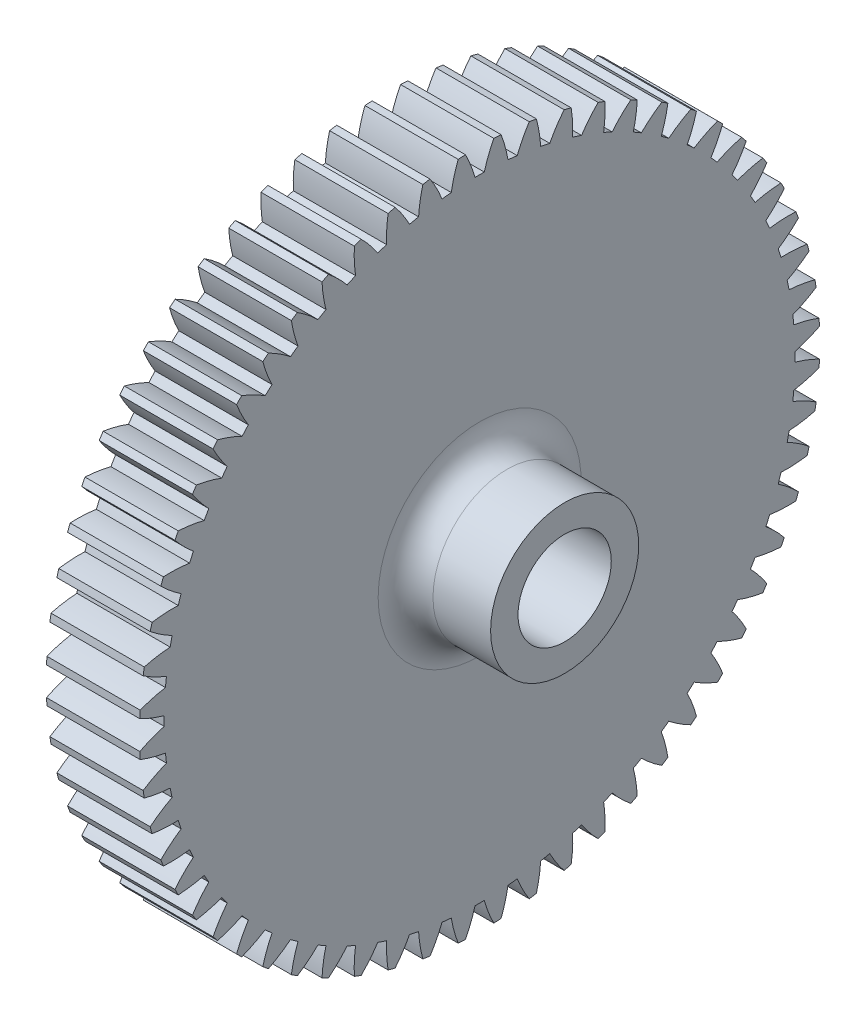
SolidWorks part; units mm, degrees
ref_plane "Plane1" through (0, 0, 0) normal (0, 0, 1) x (1, 0, 0)
ref_plane "Plane2" through (0, 0, 0) normal (0, 1, 0) x (1, 0, 0)
ref_plane "Plane3" through (0, 0, 0) normal (1, 0, 0) x (0, 0, -1)
other "Configuration Table"
sketch "HoldingSke" plane through (0, 0, 0) normal (0, 1, 0) x (1, 0, 0)
  line L0 (0, 0) -> (0.25, -0.433)
  line L1 (-15, 0) -> (100, 0) construction
  line L2 (0, 0) -> (-2.1039, 2.3779)
  line L3 (0, 0) -> (-11.863, 4.5341)
  line L4 (0, 0) -> (4.318, 7.479)
  line L5 (0, 0) -> (-46.8476, -17.4728)
  line L6 (0, 0) -> (-14.0924, -9.5082)
  line L7 (-2.1039, 2.3779) -> (8.6586, 51.2059)
  line L8 (-76.2, 54.61) -> (-76.1, 54.61)
  line L9 (-71.009, 38.7566) -> (-53.1078, 45.2721)
  line L10 (-76.2, 71.12) -> (104.1128, 71.12)
  line L11 (0, 0) -> (-17, 0)
  line L12 (-76.2, 101.6) -> (-76.133, 101.6)
  line L13 (24.9733, 27.94) -> (52.9518, 28.4284)
  line L14 (24.9733, 27.94) -> (24.9743, 27.94)
  line L15 (24.9733, 27.94) -> (100.4006, 29.5858)
  line L16 (-63.627, -2) -> (-12.827, -2)
  circle A0 centre (0, 0) radius 0.4
  circle A1 centre (0, 0) radius 37.5
  circle A2 centre (0, 0) radius 37.5
  circle A3 centre (0, 0) radius 0.4
sketch "BasProSke" plane through (0, 0, 0) normal (0, 1, 0) x (1, 0, 0)
  line L0 (-10, 0) -> (60, 0) construction
  line L1 (0, 0) -> (0, 62)
  line L2 (0, 0) -> (17, 0)
  line L3 (17, 0) -> (17, 62)
  line L4 (17, 62) -> (0, 62)
revolve "Base-Revolve" add sketch "BasProSke" angle 360 about L0
sketch "TooCutSke" plane through (0, 0, 0) normal (1, 0, 0) x (0, 0, -1)
  line L1 (0, 0) -> (0, 107) construction
  line L2 (0, 0) -> (-1.6879, 59.9763) construction
  line L3 (0, 0) -> (-6.2785, 119.8004) construction
  line L4 (-1.6879, 59.9763) -> (-3.1392, 59.9002) construction
  arc A0 (0.8455, 57.4928) -> (-0.8455, 57.4928) centre (0, 0) ccw
  arc A1 (2.5963, 61.971) -> (-2.5963, 61.971) centre (0, 0) ccw
  circle A2 centre (0, 0) radius 60 construction
  circle A3 centre (0, 0) radius 56.3816 construction
  arc A4 (-0.8455, 57.4928) -> (-2.5963, 61.971) centre (-23.9609, 51.0368) ccw
  arc A5 (2.5963, 61.971) -> (0.8455, 57.4928) centre (23.9609, 51.0368) ccw
extrude "ToothCut" cut sketch "TooCutSke" along normal through all
fillet "Breaks" [suppressed] radius 0.04
fillet "RootFillets" [suppressed] radius 0.501
pattern_circular "TeethCuts" count 60 every 6 about axis through (-10, 0, 0) along (1, 0, 0) of "ToothCut", "RootFillets", "Breaks"
sketch "HubNeaOneSke" plane through (0, 0, 0) normal (-1, 0, 0) x (0, 0, 1)
  circle A0 centre (0, 0) radius 37.5
extrude "HubNearOne" [suppressed] add sketch "HubNeaOneSke" along normal blind 33.0001
sketch "HubNeaBotSke" plane through (0, 0, 0) normal (-1, 0, 0) x (0, 0, 1)
  circle A0 centre (0, 0) radius 37.5
extrude "HubNearBoth" [suppressed] add sketch "HubNeaBotSke" along normal blind 16.5
ref_plane "FarPln" through (17, 0, 0) normal (1, 0, 0) x (0, 0, -1)
sketch "HubFarSke" plane through (17, 0, 0) normal (1, 0, 0) x (0, 0, -1)
  circle A0 centre (0, 0) radius 37.5
extrude "HubFar" [suppressed] add sketch "HubFarSke" along normal blind 16.5
sketch "BorSke" plane through (0, 0, 0) normal (1, 0, 0) x (0, 0, -1)
  circle A0 centre (0, 0) radius 0.4
extrude "Bore" cut sketch "BorSke" along normal mid plane 100.0001
sketch "KeySke" plane through (0, 0, 0) normal (1, 0, 0) x (0, 0, -1)
  line L0 (-0.05, 0) -> (-0.05, 0.5)
  line L1 (-0.05, 0.5) -> (0.05, 0.5)
  line L2 (0.05, 0.5) -> (0.05, 0)
  line L3 (0, 0) -> (0, 34) construction
  line L4 (-0.05, 0) -> (0.05, 0)
extrude "Keyway" [suppressed] cut sketch "KeySke" along normal mid plane 100.0001
pattern_circular "Keyway2" [suppressed] count 2 every 90 about axis through (-10, 0, 0) along (1, 0, 0)
sketch "Croquis1" plane through (17, 0, 0) normal (1, 0, 0) x (0, 0, -1)
  line L0 (0, 0) -> (0, 7.5) construction
  line L1 (-0.5433, 6.8284) -> (-0.6, 7.476)
  line L2 (0.5433, 6.8284) -> (0.6, 7.476)
  line L3 (1.8249, 6.6024) -> (1.9931, 7.2303)
  line L4 (2.846, 6.2308) -> (3.1207, 6.8199)
  line L5 (3.973, 5.5801) -> (4.3458, 6.1126)
  line L6 (4.8054, 4.8816) -> (5.2651, 5.3412)
  line L7 (5.6419, 3.8848) -> (6.1744, 4.2576)
  line L8 (6.1853, 2.9437) -> (6.7744, 3.2184)
  line L9 (6.6303, 1.7208) -> (7.2582, 1.8891)
  line L10 (6.819, 0.6506) -> (7.4666, 0.7073)
  line L11 (6.819, -0.6506) -> (7.4666, -0.7073)
  line L12 (6.6303, -1.7208) -> (7.2582, -1.8891)
  line L13 (6.1853, -2.9437) -> (6.7744, -3.2184)
  line L14 (5.6419, -3.8848) -> (6.1744, -4.2576)
  line L15 (4.8054, -4.8816) -> (5.2651, -5.3412)
  line L16 (3.973, -5.5801) -> (4.3458, -6.1126)
  line L17 (2.846, -6.2308) -> (3.1207, -6.8199)
  line L18 (1.8249, -6.6024) -> (1.9931, -7.2303)
  line L19 (0.5433, -6.8284) -> (0.6, -7.476)
  line L20 (-0.5433, -6.8284) -> (-0.6, -7.476)
  line L21 (-1.8249, -6.6024) -> (-1.9931, -7.2303)
  line L22 (-2.846, -6.2308) -> (-3.1207, -6.8199)
  line L23 (-3.973, -5.5801) -> (-4.3458, -6.1126)
  line L24 (-4.8054, -4.8816) -> (-5.2651, -5.3412)
  line L25 (-5.6419, -3.8848) -> (-6.1744, -4.2576)
  line L26 (-6.1853, -2.9437) -> (-6.7744, -3.2184)
  line L27 (-6.6303, -1.7208) -> (-7.2582, -1.8891)
  line L28 (-6.819, -0.6506) -> (-7.4666, -0.7073)
  line L29 (-6.819, 0.6506) -> (-7.4666, 0.7073)
  line L30 (-6.6303, 1.7208) -> (-7.2582, 1.8891)
  line L31 (-6.1853, 2.9437) -> (-6.7744, 3.2184)
  line L32 (-5.6419, 3.8848) -> (-6.1744, 4.2576)
  line L33 (-4.8054, 4.8816) -> (-5.2651, 5.3412)
  line L34 (-3.973, 5.5801) -> (-4.3458, 6.1126)
  line L35 (-2.846, 6.2308) -> (-3.1207, 6.8199)
  line L36 (-1.8249, 6.6024) -> (-1.9931, 7.2303)
  arc A0 (-0.5433, 6.8284) -> (-1.8249, 6.6024) centre (0, 0) ccw
  arc A1 (0.6, 7.476) -> (-0.6, 7.476) centre (0, 0) ccw
  arc A2 (3.1207, 6.8199) -> (1.9931, 7.2303) centre (0, 0) ccw
  arc A3 (5.2651, 5.3412) -> (4.3458, 6.1126) centre (0, 0) ccw
  arc A4 (6.7744, 3.2184) -> (6.1744, 4.2576) centre (0, 0) ccw
  arc A5 (7.4666, 0.7073) -> (7.2582, 1.8891) centre (0, 0) ccw
  arc A6 (7.2582, -1.8891) -> (7.4666, -0.7073) centre (0, 0) ccw
  arc A7 (6.1744, -4.2576) -> (6.7744, -3.2184) centre (0, 0) ccw
  arc A8 (4.3458, -6.1126) -> (5.2651, -5.3412) centre (0, 0) ccw
  arc A9 (1.9931, -7.2303) -> (3.1207, -6.8199) centre (0, 0) ccw
  arc A10 (-0.6, -7.476) -> (0.6, -7.476) centre (0, 0) ccw
  arc A11 (-3.1207, -6.8199) -> (-1.9931, -7.2303) centre (0, 0) ccw
  arc A12 (-5.2651, -5.3412) -> (-4.3458, -6.1126) centre (0, 0) ccw
  arc A13 (-6.7744, -3.2184) -> (-6.1744, -4.2576) centre (0, 0) ccw
  arc A14 (-7.4666, -0.7073) -> (-7.2582, -1.8891) centre (0, 0) ccw
  arc A15 (-7.2582, 1.8891) -> (-7.4666, 0.7073) centre (0, 0) ccw
  arc A16 (-6.1744, 4.2576) -> (-6.7744, 3.2184) centre (0, 0) ccw
  arc A17 (-4.3458, 6.1126) -> (-5.2651, 5.3412) centre (0, 0) ccw
  arc A18 (-1.9931, 7.2303) -> (-3.1207, 6.8199) centre (0, 0) ccw
  arc A19 (-2.846, 6.2308) -> (-3.973, 5.5801) centre (0, 0) ccw
  arc A20 (-4.8054, 4.8816) -> (-5.6419, 3.8848) centre (0, 0) ccw
  arc A21 (-6.1853, 2.9437) -> (-6.6303, 1.7208) centre (0, 0) ccw
  arc A22 (-6.819, 0.6506) -> (-6.819, -0.6506) centre (0, 0) ccw
  arc A23 (-6.6303, -1.7208) -> (-6.1853, -2.9437) centre (0, 0) ccw
  arc A24 (-5.6419, -3.8848) -> (-4.8054, -4.8816) centre (0, 0) ccw
  arc A25 (-3.973, -5.5801) -> (-2.846, -6.2308) centre (0, 0) ccw
  arc A26 (-1.8249, -6.6024) -> (-0.5433, -6.8284) centre (0, 0) ccw
  arc A27 (0.5433, -6.8284) -> (1.8249, -6.6024) centre (0, 0) ccw
  arc A28 (2.846, -6.2308) -> (3.973, -5.5801) centre (0, 0) ccw
  arc A29 (4.8054, -4.8816) -> (5.6419, -3.8848) centre (0, 0) ccw
  arc A30 (6.1853, -2.9437) -> (6.6303, -1.7208) centre (0, 0) ccw
  arc A31 (5.6419, 3.8848) -> (4.8054, 4.8816) centre (0, 0) ccw
  arc A32 (3.973, 5.5801) -> (2.846, 6.2308) centre (0, 0) ccw
  arc A33 (1.8249, 6.6024) -> (0.5433, 6.8284) centre (0, 0) ccw
  arc A34 (6.819, -0.6506) -> (6.819, 0.6506) centre (0, 0) ccw
  arc A35 (6.6303, 1.7208) -> (6.1853, 2.9437) centre (0, 0) ccw
  point P78 (0, 0)
  dimension "D1" = 13.7
  dimension "D2" = 15
  dimension "D3" = 10
  dimension "D4" = 1.2
  dimension "D5" = 18
extrude "Cortar-Extruir1" cut sketch "Croquis1" against normal through all
sketch "Croquis2" plane through (17, 0, 0) normal (1, 0, 0) x (0, 0, -1)
  circle A0 centre (0, 0) radius 8.5
  circle A1 centre (0, 0) radius 13.5
  dimension "D1" = 5
  dimension "D2" = 17
extrude "Saliente-Extruir1" add sketch "Croquis2" along normal blind 15.5
fillet "Redondeo1" radius 5 1 edges at (17, 0, 13.5)
equation "' \"Module@HoldingSke\" = 6.35"
equation "' \"Num_teeth@HoldingSke\" = 12"
equation "' \"Ap@HoldingSke\" =  20"
equation "' \"Ap@HoldingSke\" = 20"
equation "' \"Width@HoldingSke\" = 0.5 * 25.4"
equation "' \"Hub_dia@HoldingSke\"= 1 * 25.4"
equation "' \"Hub_dia@HoldingSke\" = 1 * 25.4"
equation "' \"Overall_len@HoldingSke\" = 1.0 * 25.4"
equation "' \"Bore@HoldingSke\" = 0.75 * 25.4"
equation "' \"T_dim@HoldingSke\" = 0.1 * 25.4"
equation "' \"Width@KeySke\" = 0.25 * 25.4"
equation "' \"Show_teeth@HoldingSke\" = 13"
equation "' \"Backlash@HoldingSke\" = 0.009 * 25.4"
equation "' \"Addendum_fac@HoldingSke\" = 1.0"
equation "' \"Dedendum_fac@HoldingSke\" = 1.25"
equation "' \"Dedendum_add@HoldingSke\" = 0.00005 * 25.4"
equation "' \"Clearance_fac@HoldingSke\" = 0.25"
equation "\"Pitch@HoldingSke\" = 1 / \"Module@HoldingSke\""
equation "\"Overcut_dia@TooCutSke\" = (\"Num_teeth@HoldingSke\" + 2 * \"Addendum_fac@HoldingSke\") / \"Pitch@HoldingSke\" + 0.002 * 25.4"
equation "\"Pitch_dia@TooCutSke\" = \"Num_teeth@HoldingSke\" / \"Pitch@HoldingSke\""
equation "\"Base_dia@TooCutSke\" = \"Num_teeth@HoldingSke\" / \"Pitch@HoldingSke\" * cos((\"Ap@HoldingSke\"  * 3.14159265 / 180))"
equation "\"Root_dia@TooCutSke\" = (\"Num_teeth@HoldingSke\" + 2) / \"Pitch@HoldingSke\" - 2 * (\"Addendum_fac@HoldingSke\" + \"Dedendum_fac@HoldingSke\") / \"Pitch@HoldingSke\" - \"Dedendum_add@HoldingSke\" * 2"
equation "\"Half_ang@TooCutSke\" = 180 / \"Num_teeth@HoldingSke\""
equation "\"Half_CT@TooCutSke\" = \"Num_teeth@HoldingSke\" / \"Pitch@HoldingSke\" * sin((3.14159265 / 2 / \"Num_teeth@HoldingSke\")) / 2 - 7 * \"Backlash@HoldingSke\" / 4"
equation "\"Flank_rad@TooCutSke\" = \"Num_teeth@HoldingSke\" / \"Pitch@HoldingSke\" / 5"
equation "\"Radius@RootFillets\" = \"Clearance_fac@HoldingSke\" / \"Pitch@HoldingSke\" + \"Dedendum_add@HoldingSke\""
equation "\"Break_rad@Breaks\" = 0.02 / \"Pitch@HoldingSke\""
equation "\"Thickness@HoldingSke\" = \"Width@HoldingSke\""
equation "\"OAL@HoldingSke\" = \"Thickness@HoldingSke\""
equation "\"MHD@HoldingSke\" = (\"Num_teeth@HoldingSke\" + 2) / \"Pitch@HoldingSke\" - 2 * (\"Addendum_fac@HoldingSke\" + \"Dedendum_fac@HoldingSke\")  / \"Pitch@HoldingSke\" - \"Dedendum_add@HoldingSke\" * 2"
equation "\"MBD@HoldingSke\" = (\"Num_teeth@HoldingSke\" + 2) / \"Pitch@HoldingSke\" - 2 * (\"Addendum_fac@HoldingSke\" + \"Dedendum_fac@HoldingSke\")  / \"Pitch@HoldingSke\" - \"Dedendum_add@HoldingSke\" * 2 - 0.002 * 25.4"
equation "\"MHD@HoldingSke\" = ((sgn( \"MHD@HoldingSke\" - \"Hub_dia@HoldingSke\" )-1)*( \"MHD@HoldingSke\" - \"Hub_dia@HoldingSke\" ))/-2+ \"Hub_dia@HoldingSke\""
equation "\"MBD@HoldingSke\" = ((sgn( \"MBD@HoldingSke\" - \"Bore@HoldingSke\" )-1)*( \"MBD@HoldingSke\" - \"Bore@HoldingSke\" ))/-2+ \"Bore@HoldingSke\""
equation "\"OAL@HoldingSke\" = ((sgn( \"OAL@HoldingSke\" - \"Overall_len@HoldingSke\" )+1)*( \"OAL@HoldingSke\" - \"Overall_len@HoldingSke\" ))/2 + \"Overall_len@HoldingSke\" + 0.000002 * 25.4"
equation "\"Num_teeth@TeethCuts\" = int( \"Show_teeth@HoldingSke\" ) + 1"
equation "\"Num_teeth@TeethCuts\" = ((sgn( \"Num_teeth@TeethCuts\" - \"Num_teeth@HoldingSke\" )-1)*( \"Num_teeth@TeethCuts\" - \"Num_teeth@HoldingSke\" ))/-2+ \"Num_teeth@HoldingSke\""
equation "\"Num_teeth@TeethCuts\" = ((sgn( \"Num_teeth@TeethCuts\" - 2.0)+1)*( \"Num_teeth@TeethCuts\" - 2.0))/2 +2.0"
equation "\"Angle@TeethCuts\" = 360.0 / \"Num_teeth@HoldingSke\""
equation "\"Diameter@BasProSke\" = (\"Num_teeth@HoldingSke\" + 2 * \"Addendum_fac@HoldingSke\") / \"Pitch@HoldingSke\""
equation "\"Thickness@BasProSke\"  = \"Thickness@HoldingSke\""
equation "' \"Fillet_rad@BasProSke\" =  \"Thickness@HoldingSke\" * 0.05"
equation "' \"Fillet_rad@BasProSke\" = \"Thickness@HoldingSke\" * 0.05"
equation "\"MHD@HoldingSke\" = ((sgn( \"MHD@HoldingSke\" - \"Root_dia@TooCutSke\" )-1)*( \"MHD@HoldingSke\" - \"Root_dia@TooCutSke\" ))/-2+ \"Root_dia@TooCutSke\""
equation "\"Diameter@HubNeaOneSke\" = \"MHD@HoldingSke\""
equation "\"Length@HubNearOne\" = \"OAL@HoldingSke\" - \"Thickness@BasProSke\""
equation "\"Diameter@HubNeaBotSke\" = \"MHD@HoldingSke\""
equation "\"Length@HubNearBoth\" = ( \"OAL@HoldingSke\" - \"Thickness@BasProSke\" ) / 2.0"
equation "\"Thickness@FarPln\" = \"Thickness@BasProSke\""
equation "\"Diameter@HubFarSke\" = \"MHD@HoldingSke\""
equation "\"Length@HubFar\" = ( \"OAL@HoldingSke\" - \"Thickness@BasProSke\" ) / 2.0"
equation "\"Diameter@BorSke\" = \"MBD@HoldingSke\""
equation "\"D1@Bore\" = \"OAL@HoldingSke\" * 2.0"
equation "\"D1@Keyway\" = \"OAL@HoldingSke\" * 2.0"
equation "\"Offset@KeySke\" = \"T_dim@HoldingSke\" + \"MBD@HoldingSke\" / 2.0"
